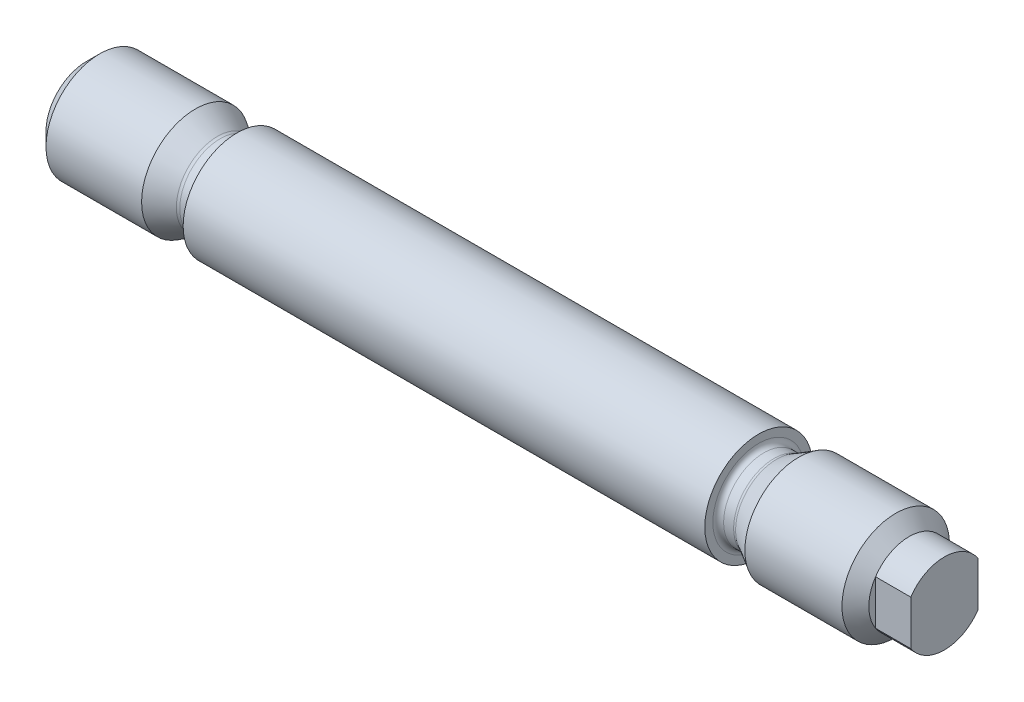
SolidWorks part; units mm, degrees
revolve "BaseBody" add sketch "BodySke" angle 360 about L14
sketch "BodySke" plane through (0, 0, 0) normal (0, 0, 1) x (1, 0, 0)
  line L0 (19.5, 6.1072) -> (16.2215, 8)
  line L1 (16.2215, 8) -> (2, 8)
  line L2 (22.4, 8) -> (22.4, 6.8)
  line L3 (21.6, 6) -> (19.9, 6)
  line L5 (2, 8) -> (0, 6)
  line L7 (100, 8) -> (100, 6.8)
  line L8 (100.8, 6) -> (102.2856, 6)
  line L9 (102.6856, 6.1072) -> (105.9641, 8)
  line L10 (105.9641, 8) -> (120.4, 8)
  line L11 (120.4, 8) -> (122.4, 6)
  line L12 (122.4, 6) -> (122.4, 0)
  line L13 (122.4, 0) -> (0, 0)
  line L14 (-3.175, 0) -> (101.6, 0) construction
  line L15 (108.7794, -6) -> (122.4, -6) construction
  line L16 (100, -6) -> (102.5, -6) construction
  line L17 (37.0699, -8) -> (100, -8) construction
  line L18 (0, 6) -> (0, 0)
  line L19 (22.4, 8) -> (100, 8)
  line L20 (104.5, 10.8514) -> (104.5, -6.5014) construction
  line L21 (100, 10.2761) -> (100, -5.5735) construction
  arc A0 (19.9, 6) -> (19.5, 6.1072) centre (19.9, 6.8) cw
  arc A1 (22.4, 6.8) -> (21.6, 6) centre (21.6, 6.8) cw
  arc A2 (102.2856, 6) -> (102.6856, 6.1072) centre (102.2856, 6.8) ccw
  arc A3 (100, 6.8) -> (100.8, 6) centre (100.8, 6.8) ccw
  point P26 (102.5, 6)
  point P29 (100, 6)
ref_plane "Plane1" through (0, 0, 0) normal (0, 0, 1) x (1, 0, 0)
ref_plane "Plane2" through (0, 0, 0) normal (0, 1, 0) x (1, 0, 0)
ref_plane "Plane3" through (0, 0, 0) normal (1, 0, 0) x (0, 0, -1)
sketch "ThdSchSke" plane through (0, 0, 0) normal (0, 0, 1) x (1, 0, 0)
  line L0 (104.5, -6) -> (103.0996, -8)
  line L1 (104.5, -6) -> (105.9004, -8)
  line L2 (105.9004, -8) -> (105.9004, -10)
  line L3 (-3.175, 0) -> (5.1513, 0) construction
  line L5 (105.9004, -10) -> (103.0996, -10)
  line L6 (103.0996, -10) -> (103.0996, -8)
  line L7 (122.4, -6) -> (122.4, 6) construction
revolve "ThreadSchematic" [suppressed] cut sketch "ThdSchSke" angle 360 about L3
pattern_linear "ThdSchPat" [suppressed]
sketch "ThdSchSketStud" plane through (0, 0, 0) normal (0, 0, 1) x (1, 0, 0)
  line L0 (17.9, -6) -> (16.4996, -8)
  line L1 (17.9, -6) -> (19.3004, -8)
  line L2 (19.3004, -8) -> (19.3004, -10)
  line L3 (-3.175, 0) -> (5.1513, 0) construction
  line L5 (19.3004, -10) -> (16.4996, -10)
  line L6 (16.4996, -10) -> (16.4996, -8)
  line L7 (0, 6) -> (0, -6) construction
revolve "ThreadSchematicStud" [suppressed] cut sketch "ThdSchSketStud" angle 360 about L3
pattern_linear "ThdSchPatStud" [suppressed]
sketch "DogPointSke" plane through (122.4, 0, 0) normal (1, 0, 0) x (0, 0, -1)
  line L0 (-5, 3.3166) -> (-5, -3.3166)
  line L1 (5, 3.3166) -> (5, -3.3166)
  line L2 (0, -9.525) -> (0, 9.525) construction
  arc A0 (-5, -3.3166) -> (5, -3.3166) centre (0, 0) ccw
  arc A2 (5, 3.3166) -> (-5, 3.3166) centre (0, 0) ccw
  dimension "Point_Dia" = 12
  dimension "Dog_Width" = 10
extrude "DogPoint" add sketch "DogPointSke" along normal blind 5.24
equation "\"Thread_len@BodySke\" = \"Thread_nom@BodySke\""
equation "\"Studend_length@BodySke\" = \"Thread_len@BodySke\""
equation "\"Thread_minor@ThreadCosmetic\" = \"Minor_dia@BodySke\""
equation "\"Thrd_Minor@ThreadCosmeticStud\" = \"Thread_minor@ThreadCosmetic\""
equation "\"Thread_minor@ThdSchSke\" = \"Minor_dia@BodySke\""
equation "\"Diameter@ThdSchSke\" = \"Thread_dia@BodySke\""
equation "\"Overcut@ThdSchSke\" = \"Thread_dia@BodySke\" * 1.25"
equation "\"Start@ThdSchSke\" = \"Thread_nom@BodySke\"  - \"Thread_neck_width@BodySke\" - \"Advance@BodySke\""
equation "\"Num_threads@ThdSchPat\" = int( \"Start@ThdSchSke\" / \"Advance@BodySke\" + 0.999 ) + 1"
equation "\"Advance@ThdSchPat\" = \"Start@ThdSchSke\" /  ( \"Num_threads@ThdSchPat\" - 1 ) 'relax it"
equation "'  \"Num_threads@ThdSchPat\" = \"Num_threads@ThdSchPat\" - sgn( \"Num_threads@ThdSchPat\" - 1 ) '---chamfered tips only---"
equation "\"Diameter@ThdSchSketStud\" = \"Diameter@ThdSchSke\""
equation "\"Thread_minor@ThdSchSketStud\" = \"Thread_minor@ThdSchSke\""
equation "\"Overcut@ThdSchSketStud\" = \"Overcut@ThdSchSke\""
equation "\"Start_@ThdSchSketStud\" = \"Studend_length@BodySke\" - \"Shoulder_neck_width@BodySke\" - \"Advance@BodySke\""
equation "\"Num_Threads@ThdSchPatStud\" = int ( \"Start_@ThdSchSketStud\" / \"Advance@BodySke\" + 0.999 )  + 1"
equation "\"Advance@ThdSchPatStud\" = \"Start_@ThdSchSketStud\" /  ( \"Num_Threads@ThdSchPatStud\" - 1 ) 'relax it"
